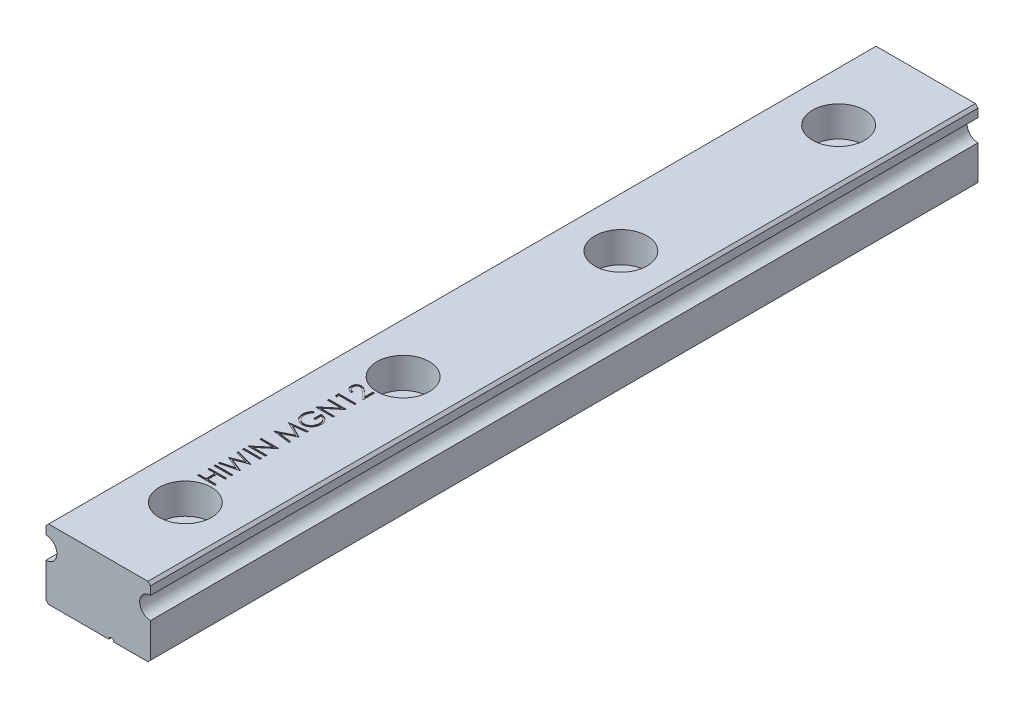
SolidWorks part; units mm, degrees
ref_plane "前视基准面" through (0, 0, 0) normal (0, 0, 1) x (1, 0, 0)
ref_plane "上视基准面" through (0, 0, 0) normal (0, 1, 0) x (1, 0, 0)
ref_plane "右视基准面" through (0, 0, 0) normal (1, 0, 0) x (0, 0, -1)
sketch "草图1" plane through (0, 0, 0) normal (0, 0, 1) x (1, 0, 0)
  line L2 (-5.7, 0) -> (1.2, 0)
  line L3 (6, 0.3) -> (6, 4.25)
  line L4 (5.7, 0) -> (6, 0.3)
  line L5 (5.7, 8) -> (-5.7, 8)
  line L6 (-6, 0.3) -> (-5.7, 0)
  line L7 (6, 7.7) -> (5.7, 8)
  line L8 (-6, 7.7) -> (-6, 6.75)
  line L9 (-6, 4.25) -> (-6, 0.3)
  line L10 (0, 8) -> (0, 0) construction
  line L11 (-5.7, 8) -> (-6, 7.7)
  line L12 (1.8, 0) -> (5.7, 0)
  line L13 (6, 6.75) -> (6, 7.7)
  arc A0 (-6, 4.25) -> (-6, 6.75) centre (-6, 5.5) ccw
  arc A1 (1.8, 0) -> (1.2, 0) centre (1.5, 0) ccw
  arc A2 (6, 6.75) -> (6, 4.25) centre (6, 5.5) ccw
extrude "凸台-拉伸1" add sketch "草图1" against normal blind 95
hole_wizard "M3 六角凹头螺钉的柱形沉头孔1" positions "草图3" profile "草图2" counterbore size "M3" standard "ISO"
sketch "草图3" plane through (1.75, 8, 16.5167) normal (0, 1, 0) x (-1, 0, 0)
  point P0 (1.75, -26.5167)
  dimension "D1" = 10
sketch "草图2" plane through (0, 8, -10) normal (1, 0, 0) x (0, 0, 1)
  line L0 (0, 0) -> (0, 8)
  line L1 (0, 8) -> (1.75, 8)
  line L3 (1.75, 8) -> (1.75, 3.5)
  line L4 (1.75, 3.5) -> (3, 3.5)
  line L5 (3, 3.5) -> (3, 0)
  line L7 (3, 0) -> (0, 0)
  line L11 (0, -6.35) -> (0, 107.95) construction
  dimension "通孔孔直径" = 3.5
  dimension "通孔孔深度" = 8
  dimension "柱形沉头孔直径" = 6
  dimension "柱形沉头孔深度" = 3.5
pattern_linear "阵列(线性)1" count 4 spacing 25 along (0, 0, -1) of "M3 六角凹头螺钉的柱形沉头孔1"
sketch "草图6" plane through (0, 8, 0) normal (0, 1, 0) x (1, 0, 0)
  line L0 (0, 10) -> (0, 35) construction
  text T0 "HIWIN MGN12" font "Century Gothic" height 2
extrude "切除-拉伸1" cut sketch "草图6" against normal blind 0.1
equation "\"D1@凸台-拉伸1\" = 2 * \"D1@草图3\" + \"D3@阵列(线性)1\" *  ( \"D1@阵列(线性)1\"  - 1) "
